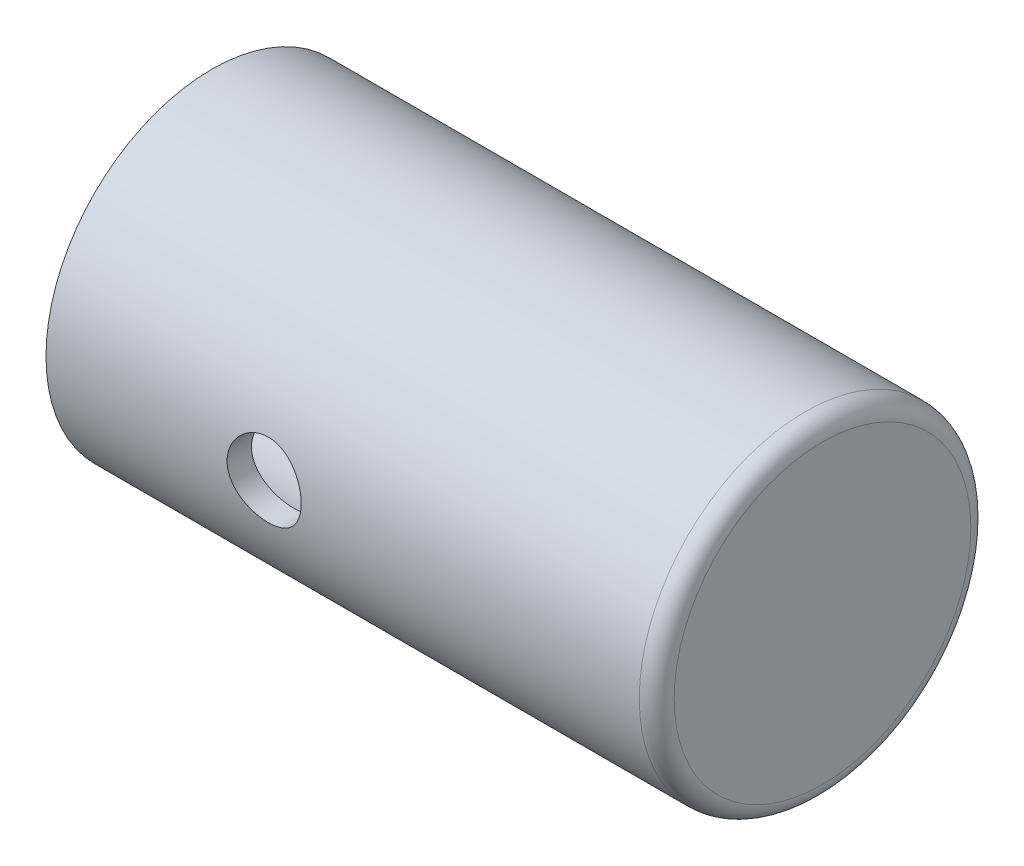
SolidWorks part; units mm, degrees
ref_plane "Plan de face" through (0, 0, 0) normal (0, 0, 1) x (1, 0, 0)
ref_plane "Plan de dessus" through (0, 0, 0) normal (0, 1, 0) x (1, 0, 0)
ref_plane "Plan de droite" through (0, 0, 0) normal (1, 0, 0) x (0, 0, -1)
sketch "Esquisse2" plane through (0, 0, 0) normal (0, 0, 1) x (1, 0, 0)
  line L0 (-7.7608, 0) -> (80.6629, 0) construction
  line L1 (0, 16.2) -> (0, 19)
  line L2 (0, 19) -> (70, 19)
  line L3 (70, 19) -> (70, 0)
  line L4 (70, 0) -> (66.5, 0)
  line L5 (66.5, 0) -> (66.5, 14.25)
  line L6 (66.5, 14.25) -> (52, 14.25)
  line L7 (0, 16.2) -> (52, 16.2)
  line L8 (52, 16.2) -> (52, 14.25)
  dimension "D1" = 70
  dimension "D2" = 38
  dimension "D3" = 32.4
  dimension "D4" = 52
  dimension "D5" = 3.5
  dimension "D6" = 28.5
revolve "Révolution1" add sketch "Esquisse2" angle 360 about L0
fillet "Congé1" radius 2 1 edges at (70, 0, 19)
sketch "Esquisse3" plane through (0, 0, 0) normal (0, 0, 1) x (1, 0, 0)
  line L0 (0, 19) -> (0, -19) construction
  circle A0 centre (25, 0) radius 4.25
  dimension "D1" = 8.5
  dimension "D2" = 25
extrude "Enlèv. mat.-Extru.1" cut sketch "Esquisse3" along normal through all
